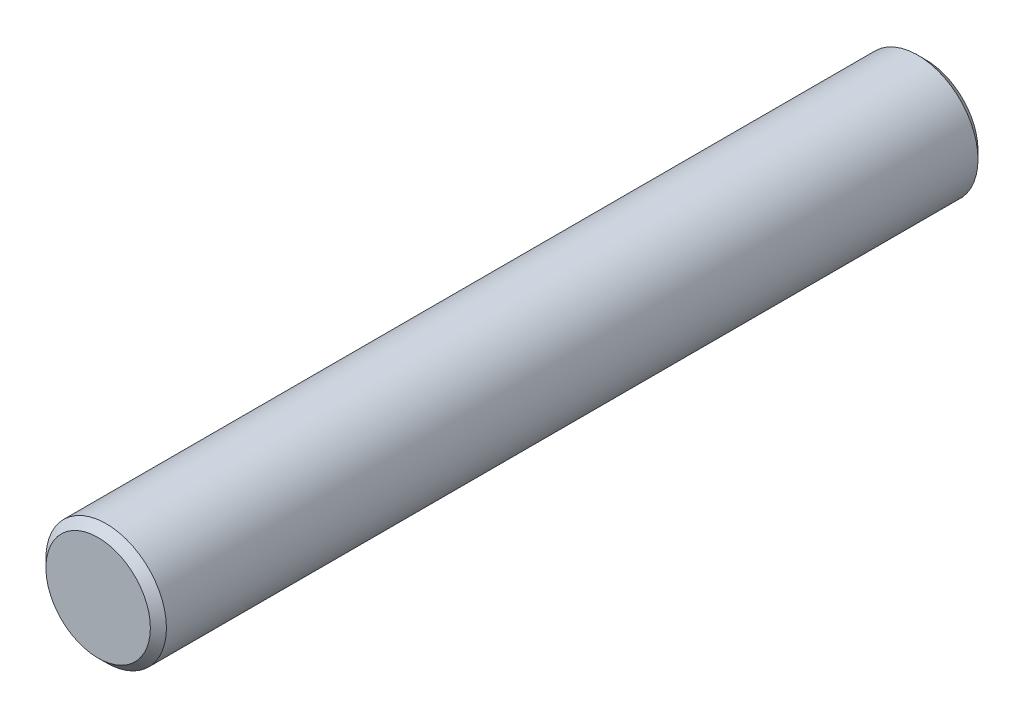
SolidWorks part; units mm, degrees
ref_plane "Face" through (0, 0, 0) normal (0, 0, 1) x (1, 0, 0)
ref_plane "Dessus" through (0, 0, 0) normal (0, 1, 0) x (1, 0, 0)
ref_plane "Droite" through (0, 0, 0) normal (1, 0, 0) x (0, 0, -1)
sketch "Esquisse1" plane through (0, 0, 0) normal (0, 0, 1) x (1, 0, 0)
  circle A0 centre (0, 0) radius 0.75
  dimension "D1" = 1.5
extrude "Boss.-Extru.1" add sketch "Esquisse1" along normal blind 10.3
chamfer "Chanfrein1" distance 0.1 angle 45 2 edges at (0.75, 0, 0) (0.75, 0, 10.3)
